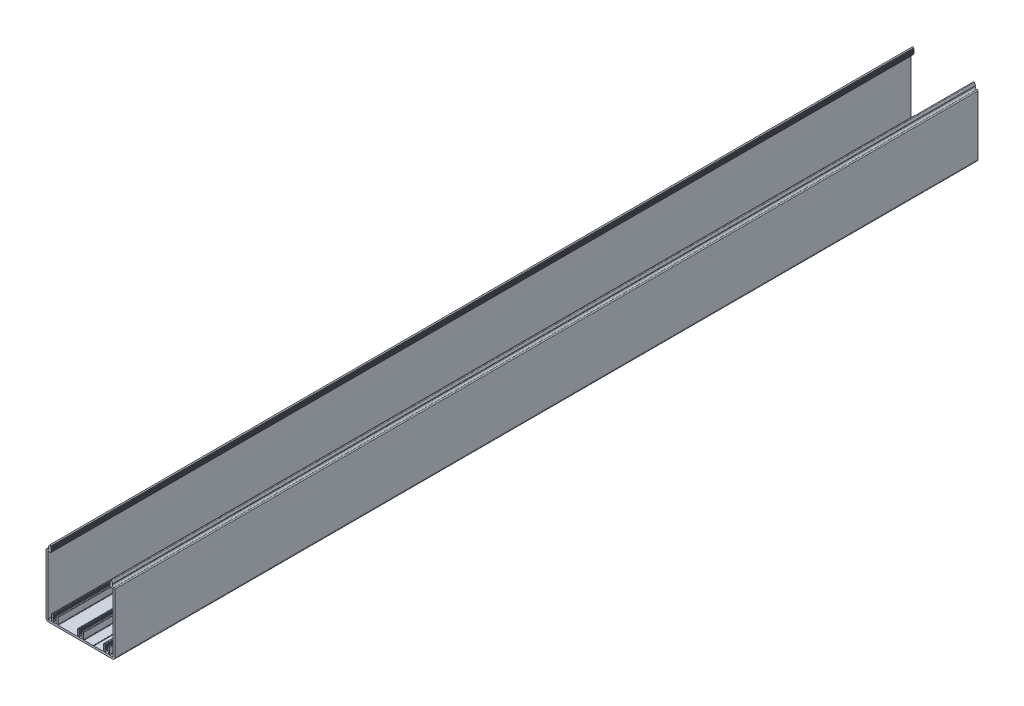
SolidWorks part; units mm, degrees
ref_plane "Ebene vorne" through (0, 0, 0) normal (0, 0, 1) x (1, 0, 0)
ref_plane "Ebene oben" through (0, 0, 0) normal (0, 1, 0) x (1, 0, 0)
ref_plane "Ebene rechts" through (0, 0, 0) normal (1, 0, 0) x (0, 0, -1)
sketch "Model" plane through (0, 0, 0) normal (0, 0, 1) x (1, 0, 0)
  line L0 (127.8018, -53.1351) -> (128.3518, -53.4526)
  line L1 (128.3518, -53.4526) -> (128.3518, -54.2175)
  line L2 (128.3518, -54.2175) -> (127.8018, -54.5351)
  line L3 (127.8018, -54.5351) -> (128.3518, -54.8526)
  line L4 (128.3518, -54.8526) -> (128.3518, -55.6175)
  line L5 (128.3518, -55.6175) -> (127.8018, -55.9351)
  line L6 (127.8018, -55.9351) -> (128.3518, -56.2526)
  line L7 (128.3518, -56.2526) -> (128.3518, -57.0175)
  line L8 (128.3518, -57.0175) -> (127.8018, -57.3351)
  line L9 (127.8018, -57.3351) -> (128.3518, -57.6526)
  line L10 (128.3518, -57.6526) -> (128.3518, -58.4175)
  line L11 (128.3518, -58.4175) -> (127.8018, -58.7351)
  line L12 (127.8018, -58.7351) -> (127.8018, -60.2851)
  line L13 (131.5518, -53.2851) -> (131.5518, -53.5175)
  line L14 (131.5518, -53.5175) -> (132.1018, -53.8351)
  line L15 (132.1018, -53.8351) -> (131.5518, -54.1526)
  line L16 (131.5518, -54.1526) -> (131.5518, -54.9175)
  line L17 (131.5518, -54.9175) -> (132.1018, -55.2351)
  line L18 (132.1018, -55.2351) -> (131.5518, -55.5526)
  line L19 (131.5518, -55.5526) -> (131.5518, -56.3175)
  line L20 (131.5518, -56.3175) -> (132.1018, -56.6351)
  line L21 (132.1018, -56.6351) -> (131.5518, -56.9526)
  line L22 (131.5518, -56.9526) -> (131.5518, -57.7175)
  line L23 (131.5518, -57.7175) -> (132.1018, -58.0351)
  line L24 (132.1018, -58.0351) -> (131.5518, -58.3526)
  line L25 (131.5518, -58.3526) -> (131.5518, -59.1175)
  line L26 (131.5518, -59.1175) -> (132.1018, -59.4351)
  line L27 (132.1018, -59.4351) -> (132.1018, -60.2851)
  line L28 (126.3018, -53.2851) -> (126.3018, -60.2851)
  line L29 (133.6018, -53.2851) -> (133.6018, -60.2851)
  line L30 (126.8018, -52.7851) -> (127.8018, -52.7851)
  line L31 (132.0518, -52.7851) -> (133.1018, -52.7851)
  line L32 (127.8018, -53.1351) -> (127.8018, -52.7851)
  line L33 (97.8018, -53.1351) -> (98.3518, -53.4526)
  line L34 (98.3518, -53.4526) -> (98.3518, -54.2175)
  line L35 (98.3518, -54.2175) -> (97.8018, -54.5351)
  line L36 (97.8018, -54.5351) -> (98.3518, -54.8526)
  line L37 (98.3518, -54.8526) -> (98.3518, -55.6175)
  line L38 (98.3518, -55.6175) -> (97.8018, -55.9351)
  line L39 (97.8018, -55.9351) -> (98.3518, -56.2526)
  line L40 (98.3518, -56.2526) -> (98.3518, -57.0175)
  line L41 (98.3518, -57.0175) -> (97.8018, -57.3351)
  line L42 (97.8018, -57.3351) -> (98.3518, -57.6526)
  line L43 (98.3518, -57.6526) -> (98.3518, -58.4175)
  line L44 (98.3518, -58.4175) -> (97.8018, -58.7351)
  line L45 (97.8018, -58.7351) -> (97.8018, -60.2851)
  line L46 (101.5518, -53.2851) -> (101.5518, -53.5175)
  line L47 (101.5518, -53.5175) -> (102.1018, -53.8351)
  line L48 (102.1018, -53.8351) -> (101.5518, -54.1526)
  line L49 (101.5518, -54.1526) -> (101.5518, -54.9175)
  line L50 (101.5518, -54.9175) -> (102.1018, -55.2351)
  line L51 (102.1018, -55.2351) -> (101.5518, -55.5526)
  line L52 (101.5518, -55.5526) -> (101.5518, -56.3175)
  line L53 (101.5518, -56.3175) -> (102.1018, -56.6351)
  line L54 (102.1018, -56.6351) -> (101.5518, -56.9526)
  line L55 (101.5518, -56.9526) -> (101.5518, -57.7175)
  line L56 (101.5518, -57.7175) -> (102.1018, -58.0351)
  line L57 (102.1018, -58.0351) -> (101.5518, -58.3526)
  line L58 (101.5518, -58.3526) -> (101.5518, -59.1175)
  line L59 (101.5518, -59.1175) -> (102.1018, -59.4351)
  line L60 (102.1018, -59.4351) -> (102.1018, -60.2851)
  line L61 (98.3018, -60.7851) -> (101.6018, -60.7851)
  line L62 (96.3018, -53.2851) -> (96.3018, -60.2851)
  line L63 (103.6018, -53.2851) -> (103.6018, -60.2851)
  line L64 (96.8018, -52.7851) -> (97.8018, -52.7851)
  line L65 (102.0518, -52.7851) -> (103.1018, -52.7851)
  line L66 (97.8018, -53.1351) -> (97.8018, -52.7851)
  line L67 (164.4584, 13.9688) -> (164.4584, 14.4631)
  line L68 (165.8614, 14.839) -> (167.0178, 12.836)
  line L69 (168.3018, 9.4149) -> (168.9518, 9.4149)
  line L70 (162.1018, -53.1351) -> (161.5518, -53.4526)
  line L71 (161.5518, -53.4526) -> (161.5518, -54.2175)
  line L72 (161.5518, -54.2175) -> (162.1018, -54.5351)
  line L73 (162.1018, -54.5351) -> (161.5518, -54.8526)
  line L74 (161.5518, -54.8526) -> (161.5518, -55.6175)
  line L75 (161.5518, -55.6175) -> (162.1018, -55.9351)
  line L76 (162.1018, -55.9351) -> (161.5518, -56.2526)
  line L77 (161.5518, -56.2526) -> (161.5518, -57.0175)
  line L78 (161.5518, -57.0175) -> (162.1018, -57.3351)
  line L79 (162.1018, -57.3351) -> (161.5518, -57.6526)
  line L80 (161.5518, -57.6526) -> (161.5518, -58.4175)
  line L81 (161.5518, -58.4175) -> (162.1018, -58.7351)
  line L82 (162.1018, -58.7351) -> (162.1018, -60.2851)
  line L83 (158.3518, -53.2851) -> (158.3518, -53.5175)
  line L84 (158.3518, -53.5175) -> (157.8018, -53.8351)
  line L85 (157.8018, -53.8351) -> (158.3518, -54.1526)
  line L86 (158.3518, -54.1526) -> (158.3518, -54.9175)
  line L87 (158.3518, -54.9175) -> (157.8018, -55.2351)
  line L88 (157.8018, -55.2351) -> (158.3518, -55.5526)
  line L89 (158.3518, -55.5526) -> (158.3518, -56.3175)
  line L90 (158.3518, -56.3175) -> (157.8018, -56.6351)
  line L91 (157.8018, -56.6351) -> (158.3518, -56.9526)
  line L92 (158.3518, -56.9526) -> (158.3518, -57.7175)
  line L93 (158.3518, -57.7175) -> (157.8018, -58.0351)
  line L94 (157.8018, -58.0351) -> (158.3518, -58.3526)
  line L95 (158.3518, -58.3526) -> (158.3518, -59.1175)
  line L96 (158.3518, -59.1175) -> (157.8018, -59.4351)
  line L97 (157.8018, -59.4351) -> (157.8018, -60.2851)
  line L98 (161.6018, -60.7851) -> (158.3018, -60.7851)
  line L99 (163.6018, -53.2851) -> (163.6018, -60.2851)
  line L100 (156.3018, -53.2851) -> (156.3018, -60.2851)
  line L101 (163.1018, -52.7851) -> (162.1018, -52.7851)
  line L102 (157.8518, -52.7851) -> (156.8018, -52.7851)
  line L103 (162.1018, -53.1351) -> (162.1018, -52.7851)
  line L104 (164.4527, 8.3644) -> (163.9018, 8.6825)
  line L105 (163.9018, 8.6825) -> (163.9018, 9.4474)
  line L106 (163.9018, 9.4474) -> (164.4518, 9.7649)
  line L107 (164.4518, 9.7649) -> (163.9018, 10.0825)
  line L108 (163.9018, 10.0825) -> (163.9018, 10.8474)
  line L109 (163.9018, 10.8474) -> (164.4518, 11.1649)
  line L110 (164.4518, 11.1649) -> (163.9018, 11.4825)
  line L111 (163.9018, 11.4825) -> (163.9018, 12.2474)
  line L112 (163.9018, 12.2474) -> (164.4518, 12.5649)
  line L113 (164.4518, 12.5649) -> (163.9018, 12.8825)
  line L114 (163.9018, 12.8825) -> (163.9018, 13.6474)
  line L115 (92.9518, -63.0851) -> (166.9518, -63.0851)
  line L116 (89.9518, 8.4149) -> (89.9518, -60.0851)
  line L117 (92.2518, -60.0851) -> (92.2518, 7.4149)
  line L118 (169.9518, 8.4149) -> (169.9518, -60.0851)
  line L119 (167.6518, -60.0851) -> (167.6518, 7.4149)
  line L120 (166.9518, -60.7851) -> (164.1018, -60.7851)
  line L121 (125.8018, -60.7851) -> (104.1018, -60.7851)
  line L122 (95.8018, -60.7851) -> (92.9518, -60.7851)
  line L123 (95.4509, 8.3644) -> (96.0018, 8.6825)
  line L124 (96.0018, 8.6825) -> (96.0018, 9.4474)
  line L125 (96.0018, 9.4474) -> (95.4518, 9.7649)
  line L126 (95.4518, 9.7649) -> (96.0018, 10.0825)
  line L127 (96.0018, 10.0825) -> (96.0018, 10.8474)
  line L128 (96.0018, 10.8474) -> (95.4518, 11.1649)
  line L129 (95.4518, 11.1649) -> (96.0018, 11.4825)
  line L130 (96.0018, 11.4825) -> (96.0018, 12.2474)
  line L131 (96.0018, 12.2474) -> (95.4518, 12.5649)
  line L132 (95.4518, 12.5649) -> (96.0018, 12.8825)
  line L133 (96.0018, 12.8825) -> (96.0018, 13.6474)
  line L134 (96.0018, 13.6474) -> (95.4451, 13.9688)
  line L135 (95.4509, 8.3644) -> (95.4507, 7.9149)
  line L136 (95.4507, 7.9149) -> (92.7518, 7.9149)
  line L137 (164.4527, 8.3644) -> (164.4529, 7.9149)
  line L138 (164.4529, 7.9149) -> (167.1518, 7.9149)
  line L139 (95.4451, 13.9688) -> (95.4451, 14.4631)
  line L140 (94.0422, 14.839) -> (92.8857, 12.836)
  line L141 (91.6018, 9.4149) -> (90.9518, 9.4149)
  line L142 (163.9018, 13.6474) -> (164.4584, 13.9688)
  line L143 (128.3018, -60.7851) -> (131.6018, -60.7851)
  line L144 (134.1018, -60.7851) -> (144.6054, -60.7851)
  line L145 (145.2982, -60.7851) -> (155.8018, -60.7851)
  arc A0 (127.8018, -60.2851) -> (128.3018, -60.7851) centre (128.3018, -60.2851) ccw
  arc A1 (131.6018, -60.7851) -> (132.1018, -60.2851) centre (131.6018, -60.2851) ccw
  arc A2 (125.8018, -60.7851) -> (126.3018, -60.2851) centre (125.8018, -60.2851) ccw
  arc A3 (133.6018, -53.2851) -> (133.1018, -52.7851) centre (133.1018, -53.2851) ccw
  arc A4 (133.6018, -60.2851) -> (134.1018, -60.7851) centre (134.1018, -60.2851) ccw
  arc A5 (126.8018, -52.7851) -> (126.3018, -53.2851) centre (126.8018, -53.2851) ccw
  arc A6 (132.0518, -52.7851) -> (131.5518, -53.2851) centre (132.0518, -53.2851) ccw
  arc A7 (97.8018, -60.2851) -> (98.3018, -60.7851) centre (98.3018, -60.2851) ccw
  arc A8 (101.6018, -60.7851) -> (102.1018, -60.2851) centre (101.6018, -60.2851) ccw
  arc A9 (95.8018, -60.7851) -> (96.3018, -60.2851) centre (95.8018, -60.2851) ccw
  arc A10 (103.6018, -53.2851) -> (103.1018, -52.7851) centre (103.1018, -53.2851) ccw
  arc A11 (103.6018, -60.2851) -> (104.1018, -60.7851) centre (104.1018, -60.2851) ccw
  arc A12 (96.8018, -52.7851) -> (96.3018, -53.2851) centre (96.8018, -53.2851) ccw
  arc A13 (102.0518, -52.7851) -> (101.5518, -53.2851) centre (102.0518, -53.2851) ccw
  arc A14 (166.9949, 11.7984) -> (167.0178, 12.836) centre (166.1518, 12.336) ccw
  arc A15 (166.9949, 11.7984) -> (168.3018, 9.4149) centre (168.3018, 10.9649) ccw
  arc A16 (169.9518, 8.4149) -> (168.9518, 9.4149) centre (168.9518, 8.4149) ccw
  arc A17 (161.6018, -60.7851) -> (162.1018, -60.2851) centre (161.6018, -60.2851) ccw
  arc A18 (157.8018, -60.2851) -> (158.3018, -60.7851) centre (158.3018, -60.2851) ccw
  arc A19 (163.6018, -60.2851) -> (164.1018, -60.7851) centre (164.1018, -60.2851) ccw
  arc A20 (156.8018, -52.7851) -> (156.3018, -53.2851) centre (156.8018, -53.2851) ccw
  arc A21 (155.8018, -60.7851) -> (156.3018, -60.2851) centre (155.8018, -60.2851) ccw
  arc A22 (163.6018, -53.2851) -> (163.1018, -52.7851) centre (163.1018, -53.2851) ccw
  arc A23 (158.3518, -53.2851) -> (157.8518, -52.7851) centre (157.8518, -53.2851) ccw
  arc A24 (92.2518, -60.0851) -> (92.9518, -60.7851) centre (92.9518, -60.0851) ccw
  arc A25 (92.7518, 7.9149) -> (92.2518, 7.4149) centre (92.7518, 7.4149) ccw
  arc A26 (166.9518, -60.7851) -> (167.6518, -60.0851) centre (166.9518, -60.0851) ccw
  arc A27 (167.6518, 7.4149) -> (167.1518, 7.9149) centre (167.1518, 7.4149) ccw
  arc A28 (89.9518, -60.0851) -> (92.9518, -63.0851) centre (92.9518, -60.0851) ccw
  arc A29 (166.9518, -63.0851) -> (169.9518, -60.0851) centre (166.9518, -60.0851) ccw
  arc A30 (92.8857, 12.836) -> (92.9086, 11.7984) centre (93.7518, 12.336) ccw
  arc A31 (91.6018, 9.4149) -> (92.9086, 11.7984) centre (91.6018, 10.9649) ccw
  arc A32 (90.9518, 9.4149) -> (89.9518, 8.4149) centre (90.9518, 8.4149) ccw
  arc A33 (165.8614, 14.839) -> (164.4584, 14.4631) centre (165.2103, 14.4631) ccw
  arc A34 (95.4451, 14.4631) -> (94.0422, 14.839) centre (94.6933, 14.4631) ccw
  arc A35 (145.2982, -60.7851) -> (144.6054, -60.7851) centre (144.9518, -60.7851) ccw
extrude "Aufsatz-Linear austragen1" add sketch "Model" along normal blind 1000
